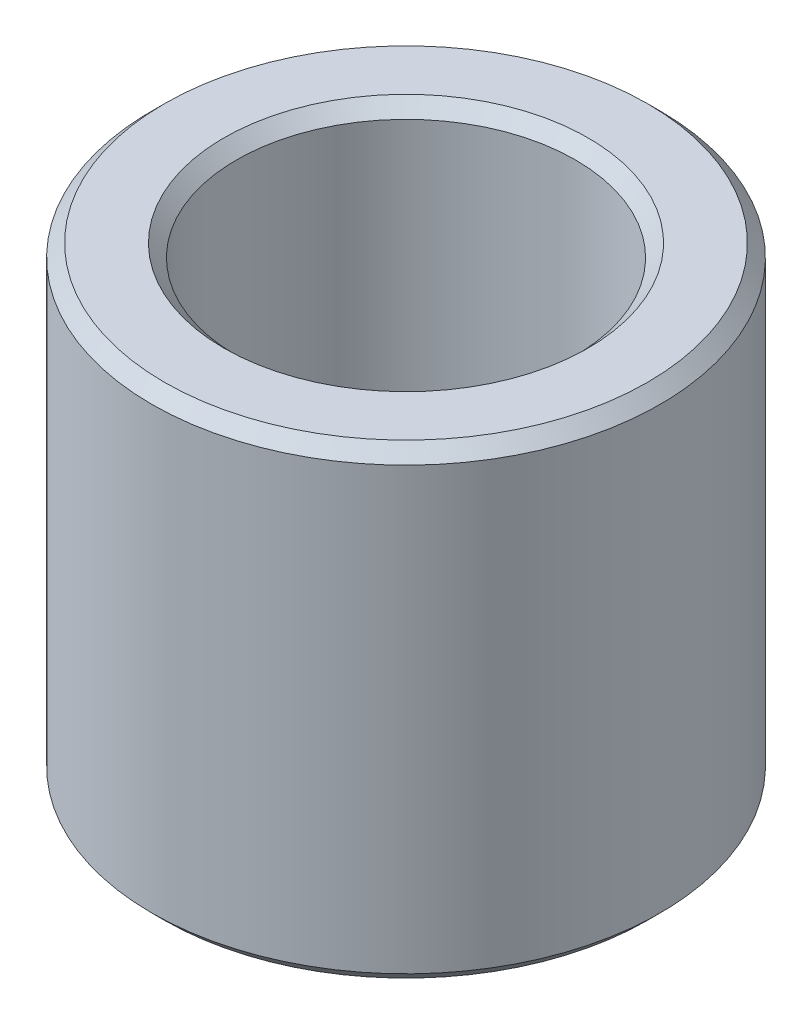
SolidWorks part; units mm, degrees
ref_plane "Plan1" through (0, 0, 0) normal (0, 0, 1) x (1, 0, 0)
ref_plane "Plan2" through (0, 0, 0) normal (0, 1, 0) x (1, 0, 0)
ref_plane "Plan3" through (0, 0, 0) normal (1, 0, 0) x (0, 0, -1)
sketch "Esquisse1" plane through (0, 0, 0) normal (0, 0, 1) x (1, 0, 0)
  line L0 (0, 30) -> (0, -20) construction
  line L1 (4, 11) -> (4, 0)
  line L2 (4, 0) -> (6, 0)
  line L3 (6, 0) -> (6, 11)
  line L4 (6, 11) -> (4, 11)
  dimension "D1" = 11
  dimension "D2" = 4
  dimension "D3" = 6
revolve "Base-Révolution" add sketch "Esquisse1" angle 360 about L0
chamfer "Chanfrein1" distance 0.3 angle 45
